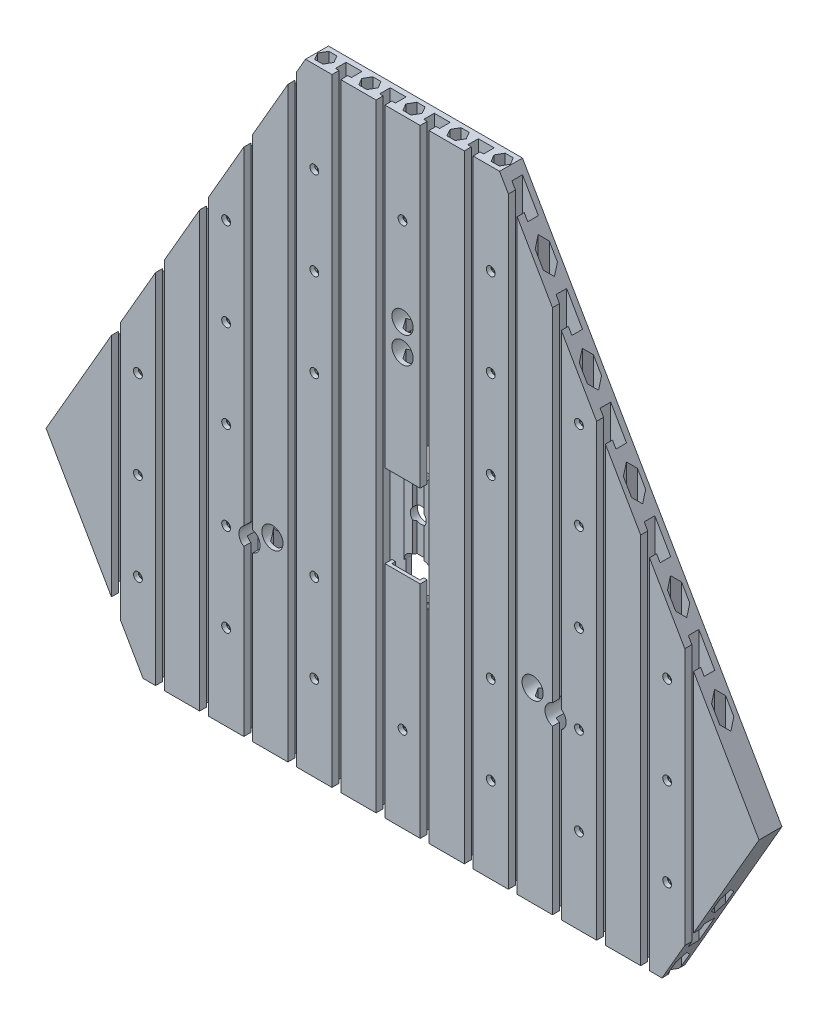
SolidWorks part; units mm, degrees
ref_plane "Plan de face" through (0, 0, 0) normal (0, 0, 1) x (1, 0, 0)
ref_plane "Plan de dessus" through (0, 0, 0) normal (0, 1, 0) x (1, 0, 0)
ref_plane "Plan de droite" through (0, 0, 0) normal (1, 0, 0) x (0, 0, -1)
sketch "Esquisse1" plane through (0, 0, 0) normal (0, 0, 1) x (1, 0, 0)
  line L6 (35.7636, 358.7862) -> (-423.8647, -437.3133) construction
  line L7 (-755.4678, -148.4209) -> (879.7592, -148.4209) construction
  line L8 (-46.1325, 376.7457) -> (415.4529, -422.7436) construction
  line L9 (257.0726, -148.4209) -> (-245.0999, 141.5085) construction
  line L10 (-257.0726, -148.4209) -> (263.2247, 151.9729) construction
  line L11 (-55, 201.5791) -> (55, 201.5791)
  line L12 (-147.0726, -148.4209) -> (147.0726, -148.4209)
  line L13 (147.0726, -148.4209) -> (202.0726, -53.1581)
  line L14 (202.0726, -53.1581) -> (55, 201.5791)
  line L15 (-147.0726, -148.4209) -> (-202.0726, -53.1581)
  line L16 (-202.0726, -53.1581) -> (-55, 201.5791)
  dimension "D1" = 60
  dimension "D2" = 60
  dimension "D3" = 110
  dimension "D4" = 350
  dimension "D5" = 60
  dimension "D6" = 60
  dimension "D7" = 110
  dimension "D8" = 110
extrude "Boss.-Extru.2" add sketch "Esquisse1" along normal blind 13
sketch "Esquisse3" plane through (0, 201.5791, 0) normal (0, 1, 0) x (1, 0, 0)
  line L0 (-12.5, 6.793) -> (-12.5, -19.2478) construction
  line L1 (-8, -3) -> (-17, -3)
  line L2 (-17, -3) -> (-17, -9)
  line L3 (-17, -9) -> (-15, -9)
  line L4 (-15, -9) -> (-15, -13)
  line L5 (55, -13) -> (-55, -13) construction
  line L6 (-10, -9) -> (-10, -13)
  line L7 (-8, -9) -> (-10, -9)
  line L8 (-8, -3) -> (-8, -9)
  line L9 (-15, -13) -> (-10, -13)
  point P2 (-12.5, -13)
  point P14 (-12.5, -3)
  dimension "D1" = 12.5
  dimension "D2" = 9
  dimension "D3" = 5
  dimension "D4" = 6
  dimension "D5" = 4
extrude "Enlèv. mat.-Extru.1" cut sketch "Esquisse3" against normal up to next
pattern_linear "Répétition linéaire1" count 8 spacing 25 along (1, 0, 0) of "Enlèv. mat.-Extru.1"
pattern_linear "Répétition linéaire2" count 7 spacing 25 along (-1, 0, 0) of "Enlèv. mat.-Extru.1"
sketch "certcleRotules" plane through (0, 0, 13) normal (0, 0, 1) x (1, 0, 0)
  circle A0 centre (0, 0) radius 157.5
  dimension "D1" = 315
sketch "Esquisse6" plane through (0, 0, 0) normal (0, 1, 0) x (1, 0, 0)
  line L0 (-157.5, -13) -> (157.5, -13) construction
  line L1 (0, 0) -> (-4.5, 0)
  line L2 (0, 0) -> (0, -13)
  line L3 (-2.5, -9) -> (-4.5, -9)
  line L4 (-4.5, 0) -> (-4.5, -9)
  line L7 (0, -13) -> (-2.5, -13)
  line L8 (-2.5, -9) -> (-2.5, -13)
  dimension "D1" = 4.5
  dimension "D2" = 2.5
  dimension "D3" = 4
revolve "Enlèvement de matière-Révolution1" cut sketch "Esquisse6" angle 360 about L2
pattern_linear "Répétition linéaire3" count 4 spacing 50 along (0, 1, 0) count 4 spacing 50 along (1, 0, 0) of "Enlèvement de matière-Révolution1"
pattern_linear "Répétition linéaire5" count 3 spacing 50 along (0, -1, 0) count 4 spacing 50 along (1, 0, 0) of "Enlèvement de matière-Révolution1"
pattern_linear "Répétition linéaire6" count 4 spacing 50 along (0, 1, 0) count 4 spacing 50 along (-1, 0, 0) of "Enlèvement de matière-Révolution1"
pattern_linear "Répétition linéaire7" count 3 spacing 50 along (0, -1, 0) count 4 spacing 50 along (-1, 0, 0) of "Enlèvement de matière-Révolution1"
sketch "Esquisse8" plane through (0, 0, 0) normal (0, 0, -1) x (-1, 0, 0)
  circle A0 centre (0, 100) radius 4.5 construction
  circle A1 centre (0, 100) radius 4.5
extrude "bouchonBarreauHaut" add sketch "Esquisse8" against normal blind 13
sketch "Esquisse7" plane through (0, 0, 0) normal (0, 0, -1) x (-1, 0, 0)
  line L1 (-6.5, 105.15) -> (6.5, 105.15)
  line L2 (-6.5, 105.15) -> (-6.5, 80.15)
  line L3 (-6.5, 80.15) -> (6.5, 80.15)
  line L4 (6.5, 105.15) -> (6.5, 80.15)
  line L5 (0, 7.15) -> (0, -7.15) construction
  dimension "D1" = 25
  dimension "D2" = 80.15
  dimension "D3" = 13
  dimension "D4" = 6.5
extrude "Boss.-Extru.4" add sketch "Esquisse7" along normal blind 5
sketch "4parties" plane through (0, 0, 0) normal (0, 0, 1) x (1, 0, 0)
  line L0 (257.0726, -148.4209) -> (-245.0999, 141.5085) construction
  line L2 (-43.3013, 25) -> (-128.5363, 74.2105)
  line L3 (-165, 11.0535) -> (-202.0726, -53.1581) construction
  line L4 (43.3013, 25) -> (128.5363, 74.2105)
  line L5 (202.0726, -53.1581) -> (165, 11.0535) construction
  line L6 (0, -50) -> (0, -148.4209)
  line L7 (-10, -148.4209) -> (10, -148.4209) construction
  line L8 (202.0726, -53.1581) -> (55, 201.5791) construction
  circle A0 centre (0, 0) radius 50
  dimension "D1" = 100
sketch "Esquisse9" plane through (0, 0, 0) normal (1, 0, 0) x (0, 0, -1)
  line L0 (5, 80.15) -> (0, 80.15) construction
  line L1 (5, 80.15) -> (5, 105.15) construction
  line L3 (5, 85.15) -> (5, 82.5)
  line L4 (5, 82.5) -> (-3, 82.5)
  line L6 (-3, -148.4209) -> (-3, 201.5791) construction
  line L7 (-13, 157.5) -> (-13, -157.5) construction
  line L8 (-3, 79.15) -> (-13, 79.15)
  line L9 (-3, 79.15) -> (-3, 82.5)
  line L10 (5, 85.15) -> (-13, 85.15)
  line L11 (-13, 79.15) -> (-13, 85.15)
  dimension "D1" = 5
  dimension "D2" = 2.65
  dimension "D3" = 6
revolve "Enlèvement de matière-Révolution2" cut sketch "Esquisse9" angle 360 about L10
pattern_linear "Répétition linéaire8" count 2 spacing 15 along (0, 1, 0) of "Enlèvement de matière-Révolution2"
pattern_circular "Répétition circulaire1" count 3 every 120 about axis through (0, 0, 0) along (0, 0, 1) of "Boss.-Extru.4", "Enlèvement de matière-Révolution2", "Répétition linéaire8"
sketch "Esquisse10" plane through (0, 0, 0) normal (1, 0, 0) x (0, 0, -1)
  line L0 (0, 201.5791) -> (0, -53.1581) construction
  line L1 (0, 77.5) -> (5, 77.5)
  line L2 (0, 77.5) -> (0, 72.5)
  line L3 (0, 72.5) -> (5, 72.5)
  line L4 (5, 77.5) -> (5, 72.5)
  line L5 (0, 50) -> (0, -50) construction
  line L6 (0, -72.5) -> (5, -72.5)
  line L7 (0, -72.5) -> (0, -77.5)
  line L8 (0, -77.5) -> (5, -77.5)
  line L9 (5, -72.5) -> (5, -77.5)
  line L10 (5, 80.15) -> (5, 105.15) construction
  line L11 (-9, 50) -> (0, 50) construction
  line L13 (-9, -100) -> (0, -100) construction
  point P16 (2.5, 72.5)
  point P19 (2.5, -72.5)
  dimension "D1" = 22.5
  dimension "D2" = 5
  dimension "D3" = 22.5
  dimension "D4" = 5
extrude "Boss.-Extru.6" add sketch "Esquisse10" along normal mid plane 250
chamfer "Chanfrein1" distance 5 angle 60 4 edges at (125, -75, -5) (-125, -75, -5) (-125, 75, -5) (125, 75, -5)
sketch "Esquisse11" plane through (0, 0, 13) normal (0, 0, 1) x (1, 0, 0)
  line L0 (-10, -148.4209) -> (-10, 201.5791) construction
  line L1 (-10, 23.5) -> (10, 23.5)
  line L2 (-10, 23.5) -> (-10, -23.5)
  line L3 (-10, -23.5) -> (10, -23.5)
  line L4 (10, 23.5) -> (10, -23.5)
  line L5 (10, -148.4209) -> (10, 201.5791) construction
  dimension "D1" = 47
  dimension "D2" = 23.5
extrude "Enlèv. mat.-Extru.2" cut sketch "Esquisse11" against normal blind 8.9
sketch "Esquisse13" plane through (-8, 0, 0) normal (-1, 0, 0) x (0, 0, 1)
  line L1 (4.1, -23.5) -> (11.1, -23.5)
  line L2 (4.1, -23.5) -> (4.1, -40)
  line L3 (4.1, -40) -> (6.1, -40)
  line L4 (11.1, -23.5) -> (11.1, -35)
  arc A0 (6.1, -40) -> (11.1, -35) centre (6.1, -35) ccw
  dimension "D2" = 5
  dimension "D1" = 16.5
  dimension "D3" = 7
extrude "Enlèv. mat.-Extru.3" cut sketch "Esquisse13" against normal up to surface (16 mm away)
sketch "Esquisse14" plane through (0, 0, 4.1) normal (0, 0, 1) x (1, 0, 0)
  line L0 (-8, 23.5) -> (-8, -40) construction
  line L1 (-3, -20) -> (3, -20)
  line L2 (-8, -25) -> (-8, -35)
  line L3 (-3, -40) -> (3, -40)
  line L4 (8, -25) -> (8, -35)
  line L5 (8, -40) -> (8, 23.5) construction
  line L6 (8, -40) -> (-8, -40) construction
  arc A0 (-8, -35) -> (-3, -40) centre (-3, -35) ccw
  arc A1 (3, -40) -> (8, -35) centre (3, -35) ccw
  arc A2 (3, -20) -> (8, -25) centre (3, -25) cw
  arc A3 (-3, -20) -> (-8, -25) centre (-3, -25) ccw
  point P16 (8, -20)
  point P19 (-8, -20)
  dimension "D3" = 5
  dimension "D1" = 20
extrude "Enlèv. mat.-Extru.4" cut sketch "Esquisse14" against normal up to next
mirror "Symétrie1" about plane through (0, 0, 0) normal (0, 1, 0) of "Enlèv. mat.-Extru.4", "Enlèv. mat.-Extru.3"
sketch "Esquisse15" plane through (0, 0, 0) normal (0, 0, -1) x (-1, 0, 0)
  circle A0 centre (-50, 0) radius 4.5 construction
  circle A1 centre (0, -50) radius 4.5 construction
  circle A2 centre (50, 0) radius 4.5 construction
  circle A3 centre (0, 50) radius 4.5 construction
  circle A4 centre (-50, 0) radius 4.5
  circle A5 centre (0, -50) radius 4.5
  circle A6 centre (50, 0) radius 4.5
  circle A7 centre (0, 50) radius 4.5
extrude "boucheTrousCEntre" add sketch "Esquisse15" against normal up to surface (13 mm away)
sketch "Esquisse16" plane through (0, -148.4209, 0) normal (0, -1, 0) x (1, 0, 0)
  line L0 (0, -9.9) -> (0, 9.9) construction
  line L1 (-2.3094, 2.5) -> (2.3094, 2.5)
  line L2 (2.3094, 2.5) -> (4.6188, 6.5)
  line L3 (4.6188, 6.5) -> (2.3094, 10.5)
  line L4 (2.3094, 10.5) -> (-2.3094, 10.5)
  line L5 (-2.3094, 10.5) -> (-4.6188, 6.5)
  line L6 (-4.6188, 6.5) -> (-2.3094, 2.5)
  line L8 (-10, 13) -> (10, 13) construction
  circle A0 centre (0, 6.5) radius 4 construction
  dimension "D1" = 6.5
  dimension "D2" = 8
extrude "Enlèv. mat.-Extru.5" cut sketch "Esquisse16" against normal through all
pattern_linear "Répétition linéaire9" count 8 spacing 25 along (1, 0, 0) of "Enlèv. mat.-Extru.5"
pattern_linear "Répétition linéaire10" count 8 spacing 25 along (-1, 0, 0) of "Enlèv. mat.-Extru.5"
sketch "Esquisse17" plane through (0, 0, 0) normal (0, 0, -1) x (-1, 0, 0)
  line L0 (0, -50) -> (0, -148.4209) construction
  line L1 (147.0726, -148.4209) -> (-147.0726, -148.4209) construction
  circle A0 centre (0, -123.4209) radius 5
  dimension "D1" = 10
  dimension "D2" = 25
extrude "Enlèv. mat.-Extru.6" cut sketch "Esquisse17" against normal up to vertex
fillet "chanfrein" radius 2 1 edges at (-5, -123.4209, 0)
pattern_linear "Répétition linéaire11" count 9 spacing 25 along (-1, 0, 0) count 13 spacing 25 along (0, 1, 0) of "Enlèv. mat.-Extru.6", "chanfrein"
mirror "Symétrie3" about plane through (0, 0, 0) normal (1, 0, 0) of "Répétition linéaire11"
